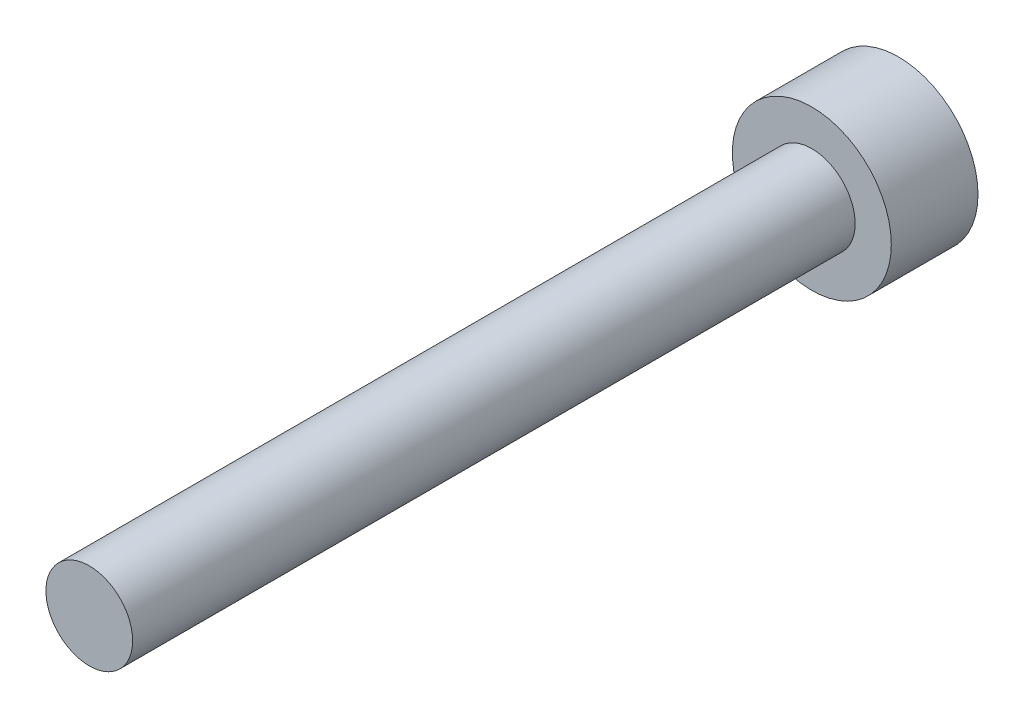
SolidWorks part; units mm, degrees
ref_plane "前视基准面" through (0, 0, 0) normal (0, 0, 1) x (1, 0, 0)
ref_plane "上视基准面" through (0, 0, 0) normal (0, 1, 0) x (1, 0, 0)
ref_plane "右视基准面" through (0, 0, 0) normal (1, 0, 0) x (0, 0, -1)
other "Configuration Table"
sketch "草图1" plane through (0, 0, 0) normal (0, 0, 1) x (1, 0, 0)
  circle A0 centre (0, 0) radius 2.75
  dimension "D1" = 5.5
extrude "Head_envelope" add sketch "草图1" along normal blind 3 from offset 3
sketch "草图2" plane through (0, 0, 0) normal (0, 0, 1) x (1, 0, 0)
  circle A0 centre (0, 0) radius 1.5
  dimension "D1" = 3
extrude "Shank_envelope_no_threads" add sketch "草图2" along normal blind 25
